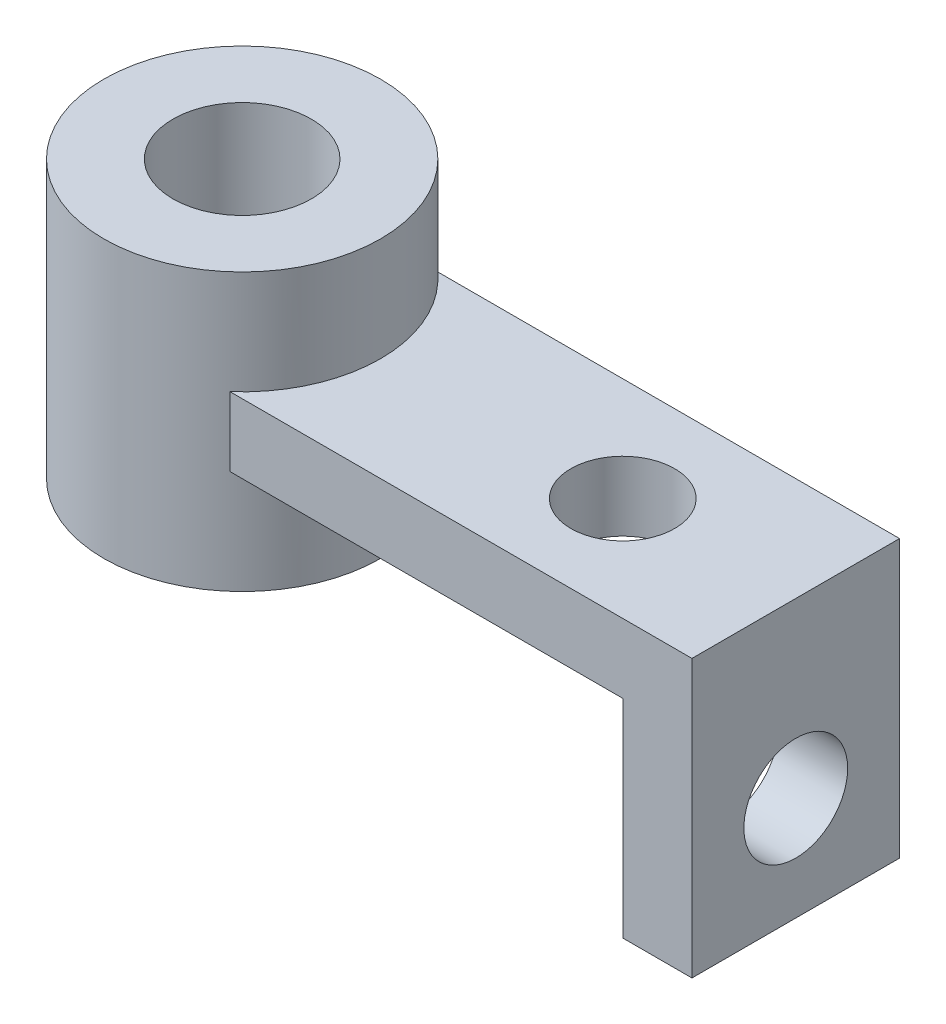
SolidWorks part; units mm, degrees
ref_plane "Front Plane" through (0, 0, 0) normal (0, 0, 1) x (1, 0, 0)
ref_plane "Top Plane" through (0, 0, 0) normal (0, 1, 0) x (1, 0, 0)
ref_plane "Right Plane" through (0, 0, 0) normal (1, 0, 0) x (0, 0, -1)
sketch "Sketch1" plane through (0, 0, 0) normal (0, 1, 0) x (1, 0, 0)
  circle A0 centre (0, 0) radius 508
  dimension "D1" = 1016
extrude "Boss-Extrude1" add sketch "Sketch1" against normal blind 1016
ref_plane "Plane1" through (0, -508, 0) normal (0, 1, 0) x (1, 0, 0)
sketch "Sketch2" plane through (0, -508, 0) normal (0, 1, 0) x (1, 0, 0)
  line L0 (0, 0) -> (2032, 0) construction
  line L1 (0, -381) -> (2032, -381)
  line L2 (0, 381) -> (2032, 381)
  line L3 (2032, 381) -> (2032, -381)
  line L4 (0, 381) -> (0, -381)
  dimension "D1" = 2032
  dimension "D2" = 381
  dimension "D3" = 381
extrude "Boss-Extrude2" add sketch "Sketch2" along normal mid plane 254
sketch "Sketch3" plane through (0, 0, 381) normal (0, 0, 1) x (1, 0, 0)
  line L0 (2032, -635) -> (2032, -1397)
  line L1 (2032, -1397) -> (1778, -1397)
  line L2 (1778, -1397) -> (1778, -635)
  line L3 (336.0104, -635) -> (2032, -635) construction
  line L8 (336.0104, -381) -> (336.0104, -635)
  line L9 (336.0104, -635) -> (2032, -635)
  line L10 (2032, -635) -> (2032, -381)
  line L11 (2032, -381) -> (336.0104, -381)
  line L13 (1778, -635) -> (2032, -635)
  dimension "D1" = 762
  dimension "D2" = 254
  dimension "D3" = 0
extrude "Boss-Extrude3" add sketch "Sketch3" against normal blind 762
sketch "Sketch4" plane through (2032, 0, 0) normal (1, 0, 0) x (0, 0, -1)
  line L0 (381, -1397) -> (0, -1397) construction
  line L1 (381, -1397) -> (-381, -1397) construction
  line L2 (0, -1397) -> (0, -1016) construction
  circle A0 centre (0, -1016) radius 190.5
  dimension "D2" = 381
  dimension "D1" = 381
extrude "Cut-Extrude3" cut sketch "Sketch4" against normal up to next
sketch "Sketch5" plane through (0, -381, 0) normal (0, 1, 0) x (1, 0, 0)
  line L0 (2032, 0) -> (1397, 0) construction
  line L1 (2032, -381) -> (2032, 381) construction
  circle A0 centre (1397, 0) radius 190.5
  dimension "D2" = 381
  dimension "D1" = 635
extrude "Cut-Extrude4" cut sketch "Sketch5" against normal up to next
sketch "Sketch6" plane through (0, 0, 0) normal (0, 1, 0) x (1, 0, 0)
  circle A0 centre (0, 0) radius 254
  dimension "D1" = 508
extrude "Cut-Extrude5" cut sketch "Sketch6" against normal through all
